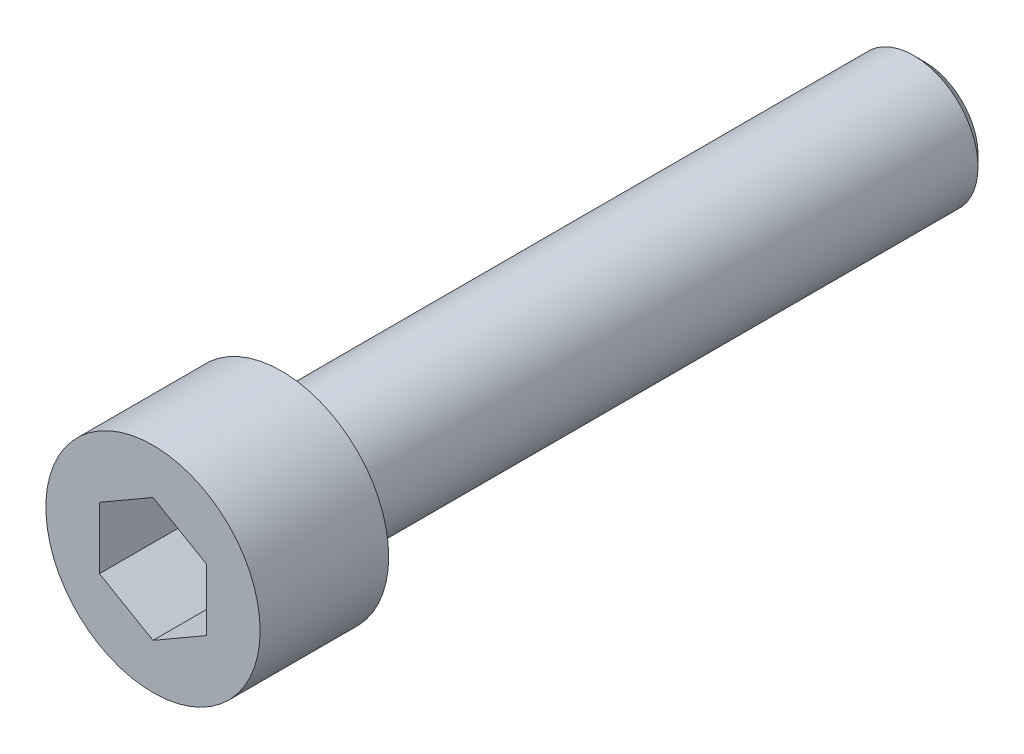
SolidWorks part; units mm, degrees
ref_plane "Front" through (0, 0, 0) normal (0, 0, 1) x (1, 0, 0)
ref_plane "Top" through (0, 0, 0) normal (0, 1, 0) x (1, 0, 0)
ref_plane "Right" through (0, 0, 0) normal (1, 0, 0) x (0, 0, -1)
sketch "Sketch1" plane through (0, 0, 0) normal (0, 0, 1) x (1, 0, 0)
  circle A0 centre (0, 0) radius 5
  dimension "D1" = 10
extrude "Base-Extrude" add sketch "Sketch1" against normal blind 6
sketch "Sketch2" plane through (0, 0, -6) normal (0, 0, -1) x (-1, 0, 0)
  circle A0 centre (0, 0) radius 3
  circle A1 centre (0, 0) radius 5 construction
  dimension "D1" = 6
extrude "Boss-Extrude1" add sketch "Sketch2" along normal blind 30
sketch "Sketch3" plane through (0, 0, 0) normal (0, 0, 1) x (1, 0, 0)
  line L0 (0, -5.5) -> (0, 5.5) construction
  line L1 (2.5, -1.4434) -> (2.5, 1.4434)
  line L2 (2.5, 1.4434) -> (0, 2.8868)
  line L3 (0, 2.8868) -> (-2.5, 1.4434)
  line L4 (-2.5, 1.4434) -> (-2.5, -1.4434)
  line L5 (-2.5, -1.4434) -> (0, -2.8868)
  line L6 (0, -2.8868) -> (2.5, -1.4434)
  circle A0 centre (0, 0) radius 2.5 construction
  dimension "D1" = 5
extrude "Cut-Extrude1" cut sketch "Sketch3" against normal blind 5
chamfer "Chamfer1" distance 0.5 angle 45 1 edges at (-3, 0, -36)
